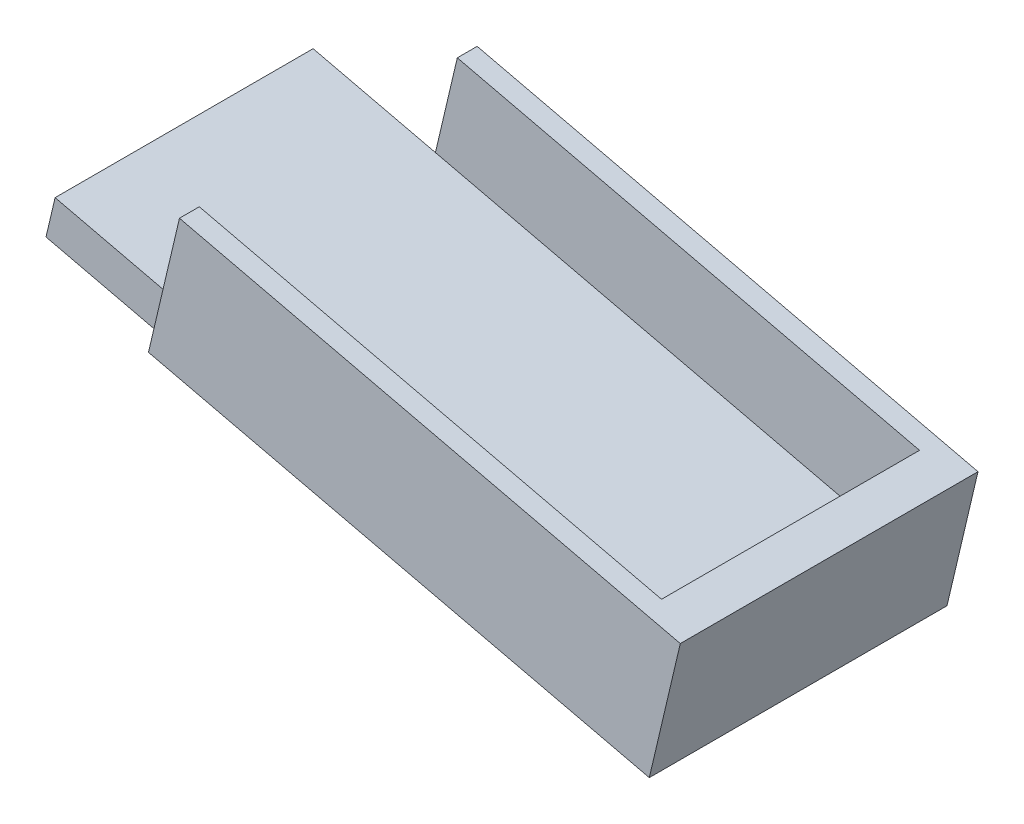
SolidWorks part; units mm, degrees
ref_plane "Front Plane" through (0, 0, 0) normal (0, 0, 1) x (1, 0, 0)
ref_plane "Top Plane" through (0, 0, 0) normal (0, 1, 0) x (1, 0, 0)
ref_plane "Right Plane" through (0, 0, 0) normal (1, 0, 0) x (0, 0, -1)
sketch "Sketch1" plane through (0, 0, 0) normal (0, 0, 1) x (1, 0, 0)
  line L0 (-0.8115, -33.5175) -> (146.4464, -68.1908)
  line L1 (-1.6231, -28.5838) -> (0, -38.4512) construction
  line L2 (146.4464, -68.1908) -> (151.9631, -44.7614)
extrude "Extrude-Thin1" add sketch "Sketch1" along normal blind 65 thin
sketch "Sketch2" plane through (0, 0, 65) normal (0, 0, 1) x (1, 0, 0)
  line L0 (161.6969, -47.0533) -> (153.8883, -80.2165)
  line L1 (161.6969, -47.0533) -> (35.5203, -17.3438)
  line L2 (153.8883, -80.2165) -> (27.7117, -50.507)
  line L3 (35.5203, -17.3438) -> (27.7117, -50.507)
extrude "Boss-Extrude1" add sketch "Sketch2" along normal blind 5
sketch "Sketch3" plane through (0, 0, 0) normal (0, 0, -1) x (-1, 0, 0)
  line L0 (-161.6969, -47.0533) -> (-35.5203, -17.3438) construction
  line L1 (-35.5203, -17.3438) -> (-27.7117, -50.507) construction
  line L2 (-27.7117, -50.507) -> (-153.8883, -80.2165) construction
  line L3 (-153.8883, -80.2165) -> (-161.6969, -47.0533) construction
  line L4 (-161.6969, -47.0533) -> (-35.5203, -17.3438)
  line L5 (-35.5203, -17.3438) -> (-27.7117, -50.507)
  line L6 (-27.7117, -50.507) -> (-153.8883, -80.2165)
  line L7 (-153.8883, -80.2165) -> (-161.6969, -47.0533)
extrude "Boss-Extrude2" add sketch "Sketch3" along normal blind 5
